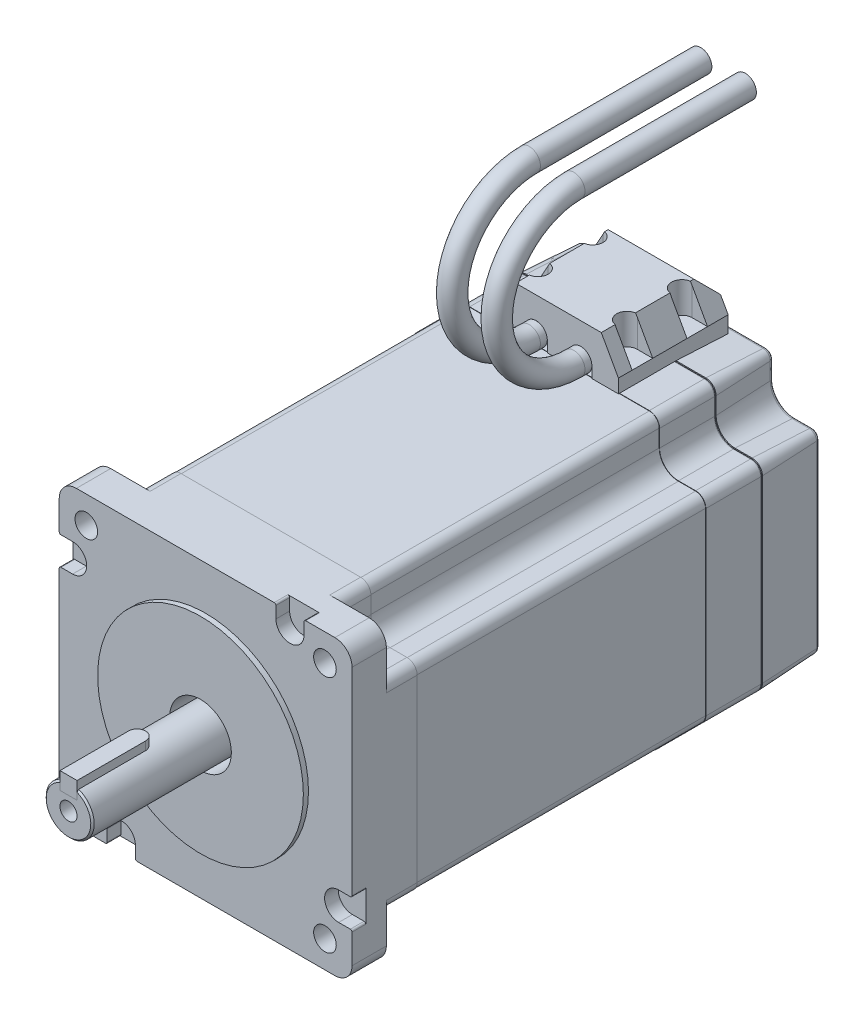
SolidWorks part; units mm, degrees
ref_plane "Front Plane" through (0, 0, 0) normal (0, 0, 1) x (1, 0, 0)
ref_plane "Top Plane" through (0, 0, 0) normal (0, 1, 0) x (1, 0, 0)
ref_plane "Right Plane" through (0, 0, 0) normal (1, 0, 0) x (0, 0, -1)
sketch "Sketch1" plane through (0, 0, 0) normal (0, 0, 1) x (1, 0, 0)
  line L1 (-42.7, -42.7) -> (42.7, -42.7)
  line L2 (-42.7, -42.7) -> (-42.7, 42.7)
  line L3 (-42.7, 42.7) -> (42.7, 42.7)
  line L4 (42.7, -42.7) -> (42.7, 42.7)
  line L5 (-42.7, -42.7) -> (42.7, 42.7) construction
  line L6 (-42.7, 42.7) -> (42.7, -42.7) construction
  point P0 (0, 0)
  dimension "D1" = 85.4
extrude "Boss-Extrude1" add sketch "Sketch1" against normal blind 20.5
sketch "Sketch2" plane through (0, 0, 0) normal (0, 0, 1) x (1, 0, 0)
  circle A0 centre (0, 0) radius 30
  dimension "D1" = 60
extrude "Cut-Extrude1" cut sketch "Sketch2" against normal blind 1.5 flip side to cut
fillet "Fillet1" radius 5 4 edges at (-42.7, -42.7, -11) (42.7, -42.7, -11) (42.7, 42.7, -11) (-42.7, 42.7, -11)
sketch "Sketch3" plane through (0, 0, -1.5) normal (0, 0, 1) x (1, 0, 0)
  line L1 (-34.8, -34.8) -> (34.8, -34.8) construction
  line L2 (-34.8, -34.8) -> (-34.8, 34.8) construction
  line L3 (-34.8, 34.8) -> (34.8, 34.8) construction
  line L4 (34.8, -34.8) -> (34.8, 34.8) construction
  line L5 (-34.8, -34.8) -> (34.8, 34.8) construction
  line L6 (-34.8, 34.8) -> (34.8, -34.8) construction
  circle A0 centre (-34.8, 34.8) radius 3.3
  circle A1 centre (34.8, 34.8) radius 3.3
  circle A2 centre (34.8, -34.8) radius 3.3
  circle A3 centre (-34.8, -34.8) radius 3.3
  circle A4 centre (0, 0) radius 9
  point P0 (0, 0)
  dimension "D1" = 6.6
  dimension "D3" = 18
  dimension "D2" = 69.6
extrude "Cut-Extrude2" cut sketch "Sketch3" against normal through all both and the other way through all
sketch "Sketch4" plane through (0, 0, -1.5) normal (0, 0, 1) x (1, 0, 0)
  line L0 (-58.8, 24.6) -> (-38.8, 24.6) construction
  line L1 (-58.8, 28.7) -> (-38.8, 28.7)
  line L2 (-58.8, 20.5) -> (-38.8, 20.5)
  line L3 (-37.7, 42.7) -> (37.7, 42.7) construction
  line L4 (-42.7, -37.7) -> (-42.7, 37.7) construction
  arc A0 (-58.8, 28.7) -> (-58.8, 20.5) centre (-58.8, 24.6) ccw
  arc A1 (-38.8, 20.5) -> (-38.8, 28.7) centre (-38.8, 24.6) ccw
  point P2 (-48.8, 24.6)
  point P11 (-34.7, 24.6)
  dimension "D1" = 8.2
  dimension "D2" = 20
  dimension "D3" = 14
  dimension "D4" = 8
extrude "Cut-Extrude3" cut sketch "Sketch4" against normal blind 4
fillet "Fillet2" radius 0.5 2 edges at (-42.7, 20.5, -3.5) (-42.7, 28.7, -3.5)
sketch "Sketch5" plane through (0, 0, -20.5) normal (0, 0, -1) x (-1, 0, 0)
  line L0 (-29.2, 42.7) -> (-29.2, 34.7)
  line L1 (-37.7, 42.7) -> (37.7, 42.7) construction
  line L2 (-34.7, 29.2) -> (-42.7, 29.2)
  line L3 (-42.7, -37.7) -> (-42.7, 37.7) construction
  line L4 (-42.7, 29.2) -> (-42.7, 42.7)
  line L5 (-42.7, 42.7) -> (-29.2, 42.7)
  arc A0 (-29.2, 34.7) -> (-34.7, 29.2) centre (-34.7, 34.7) cw
  dimension "D2" = 5.5
  dimension "D1" = 13.5
extrude "Cut-Extrude4" cut sketch "Sketch5" against normal offset from surface (9 mm away) 10
pattern_circular "CirPattern2" count 4 over 360 about axis through (0, 0, 0) along (0, 0, 1) of "Cut-Extrude3", "Fillet2"
pattern_circular "CirPattern7" count 4 over 360 about axis through (0, 0, 0) along (0, 0, 1) of "Cut-Extrude4"
fillet "Fillet3" radius 3 8 edges at (42.7, 29.2, -16) (29.2, 42.7, -16) (-42.7, 29.2, -16) (-29.2, 42.7, -16) (-29.2, -42.7, -16) (-42.7, -29.2, -16) (29.2, -42.7, -16) (42.7, -29.2, -16)
sketch "Sketch6" plane through (0, 0, -20.5) normal (0, 0, -1) x (-1, 0, 0)
  line L24 (42.6, -26.2) -> (42.6, 26.2)
  line L25 (39.7, 29.1) -> (34.7, 29.1)
  line L26 (29.1, 34.7) -> (29.1, 39.7)
  line L27 (26.2, 42.6) -> (-26.2, 42.6)
  line L28 (-29.1, 39.7) -> (-29.1, 34.7)
  line L29 (-34.7, 29.1) -> (-39.7, 29.1)
  line L30 (-42.6, 26.2) -> (-42.6, -26.2)
  line L31 (-39.7, -29.1) -> (-34.7, -29.1)
  line L32 (-29.1, -34.7) -> (-29.1, -39.7)
  line L33 (-26.2, -42.6) -> (26.2, -42.6)
  line L34 (29.1, -39.7) -> (29.1, -34.7)
  line L35 (34.7, -29.1) -> (39.7, -29.1)
  line L36 (42.6, -26.2) -> (42.6, 26.2)
  line L37 (39.7, 29.1) -> (34.7, 29.1)
  line L38 (29.1, 34.7) -> (29.1, 39.7)
  line L39 (26.2, 42.6) -> (-26.2, 42.6)
  line L40 (-29.1, 39.7) -> (-29.1, 34.7)
  line L41 (-34.7, 29.1) -> (-39.7, 29.1)
  line L42 (-42.6, 26.2) -> (-42.6, -26.2)
  line L43 (-39.7, -29.1) -> (-34.7, -29.1)
  line L44 (-29.1, -34.7) -> (-29.1, -39.7)
  line L45 (-26.2, -42.6) -> (26.2, -42.6)
  line L46 (29.1, -39.7) -> (29.1, -34.7)
  line L47 (34.7, -29.1) -> (39.7, -29.1)
  circle A12 centre (0, 0) radius 30
  arc A24 (42.6, 26.2) -> (39.7, 29.1) centre (39.7, 26.2) ccw
  arc A25 (29.1, 34.7) -> (34.7, 29.1) centre (34.7, 34.7) ccw
  arc A26 (29.1, 39.7) -> (26.2, 42.6) centre (26.2, 39.7) ccw
  arc A27 (-26.2, 42.6) -> (-29.1, 39.7) centre (-26.2, 39.7) ccw
  arc A28 (-34.7, 29.1) -> (-29.1, 34.7) centre (-34.7, 34.7) ccw
  arc A29 (-39.7, 29.1) -> (-42.6, 26.2) centre (-39.7, 26.2) ccw
  arc A30 (-42.6, -26.2) -> (-39.7, -29.1) centre (-39.7, -26.2) ccw
  arc A31 (-29.1, -34.7) -> (-34.7, -29.1) centre (-34.7, -34.7) ccw
  arc A32 (-29.1, -39.7) -> (-26.2, -42.6) centre (-26.2, -39.7) ccw
  arc A33 (26.2, -42.6) -> (29.1, -39.7) centre (26.2, -39.7) ccw
  arc A34 (34.7, -29.1) -> (29.1, -34.7) centre (34.7, -34.7) ccw
  arc A35 (39.7, -29.1) -> (42.6, -26.2) centre (39.7, -26.2) ccw
  arc A36 (42.6, 26.2) -> (39.7, 29.1) centre (39.7, 26.2) ccw
  arc A37 (29.1, 34.7) -> (34.7, 29.1) centre (34.7, 34.7) ccw
  arc A38 (29.1, 39.7) -> (26.2, 42.6) centre (26.2, 39.7) ccw
  arc A39 (-26.2, 42.6) -> (-29.1, 39.7) centre (-26.2, 39.7) ccw
  arc A40 (-34.7, 29.1) -> (-29.1, 34.7) centre (-34.7, 34.7) ccw
  arc A41 (-39.7, 29.1) -> (-42.6, 26.2) centre (-39.7, 26.2) ccw
  arc A42 (-42.6, -26.2) -> (-39.7, -29.1) centre (-39.7, -26.2) ccw
  arc A43 (-29.1, -34.7) -> (-34.7, -29.1) centre (-34.7, -34.7) ccw
  arc A44 (-29.1, -39.7) -> (-26.2, -42.6) centre (-26.2, -39.7) ccw
  arc A45 (26.2, -42.6) -> (29.1, -39.7) centre (26.2, -39.7) ccw
  arc A46 (34.7, -29.1) -> (29.1, -34.7) centre (34.7, -34.7) ccw
  arc A47 (39.7, -29.1) -> (42.6, -26.2) centre (39.7, -26.2) ccw
  dimension "D2" = 60
  dimension "D1" = 0.1
extrude "Boss-Extrude2" add sketch "Sketch6" along normal blind 84.2 separate body
sketch "Sketch7" plane through (0, 0, -104.7) normal (0, 0, -1) x (-1, 0, 0)
  line L12 (42.7, -26.2) -> (42.7, 26.2)
  line L13 (39.7, 29.2) -> (34.7, 29.2)
  line L14 (29.2, 34.7) -> (29.2, 39.7)
  line L15 (26.2, 42.7) -> (-26.2, 42.7)
  line L16 (-29.2, 39.7) -> (-29.2, 34.7)
  line L17 (-34.7, 29.2) -> (-39.7, 29.2)
  line L18 (-42.7, 26.2) -> (-42.7, -26.2)
  line L19 (-39.7, -29.2) -> (-34.7, -29.2)
  line L20 (-29.2, -34.7) -> (-29.2, -39.7)
  line L21 (-26.2, -42.7) -> (26.2, -42.7)
  line L22 (29.2, -39.7) -> (29.2, -34.7)
  line L23 (34.7, -29.2) -> (39.7, -29.2)
  line L24 (42.7, -26.2) -> (42.7, 26.2)
  line L25 (39.7, 29.2) -> (34.7, 29.2)
  line L26 (29.2, 34.7) -> (29.2, 39.7)
  line L27 (26.2, 42.7) -> (-26.2, 42.7)
  line L28 (-29.2, 39.7) -> (-29.2, 34.7)
  line L29 (-34.7, 29.2) -> (-39.7, 29.2)
  line L30 (-42.7, 26.2) -> (-42.7, -26.2)
  line L31 (-39.7, -29.2) -> (-34.7, -29.2)
  line L32 (-29.2, -34.7) -> (-29.2, -39.7)
  line L33 (-26.2, -42.7) -> (26.2, -42.7)
  line L34 (29.2, -39.7) -> (29.2, -34.7)
  line L35 (34.7, -29.2) -> (39.7, -29.2)
  arc A12 (42.7, 26.2) -> (39.7, 29.2) centre (39.7, 26.2) ccw
  arc A13 (29.2, 34.7) -> (34.7, 29.2) centre (34.7, 34.7) ccw
  arc A14 (29.2, 39.7) -> (26.2, 42.7) centre (26.2, 39.7) ccw
  arc A15 (-26.2, 42.7) -> (-29.2, 39.7) centre (-26.2, 39.7) ccw
  arc A16 (-34.7, 29.2) -> (-29.2, 34.7) centre (-34.7, 34.7) ccw
  arc A17 (-39.7, 29.2) -> (-42.7, 26.2) centre (-39.7, 26.2) ccw
  arc A18 (-42.7, -26.2) -> (-39.7, -29.2) centre (-39.7, -26.2) ccw
  arc A19 (-29.2, -34.7) -> (-34.7, -29.2) centre (-34.7, -34.7) ccw
  arc A20 (-29.2, -39.7) -> (-26.2, -42.7) centre (-26.2, -39.7) ccw
  arc A21 (26.2, -42.7) -> (29.2, -39.7) centre (26.2, -39.7) ccw
  arc A22 (34.7, -29.2) -> (29.2, -34.7) centre (34.7, -34.7) ccw
  arc A23 (39.7, -29.2) -> (42.7, -26.2) centre (39.7, -26.2) ccw
  arc A24 (42.7, 26.2) -> (39.7, 29.2) centre (39.7, 26.2) ccw
  arc A25 (29.2, 34.7) -> (34.7, 29.2) centre (34.7, 34.7) ccw
  arc A26 (29.2, 39.7) -> (26.2, 42.7) centre (26.2, 39.7) ccw
  arc A27 (-26.2, 42.7) -> (-29.2, 39.7) centre (-26.2, 39.7) ccw
  arc A28 (-34.7, 29.2) -> (-29.2, 34.7) centre (-34.7, 34.7) ccw
  arc A29 (-39.7, 29.2) -> (-42.7, 26.2) centre (-39.7, 26.2) ccw
  arc A30 (-42.7, -26.2) -> (-39.7, -29.2) centre (-39.7, -26.2) ccw
  arc A31 (-29.2, -34.7) -> (-34.7, -29.2) centre (-34.7, -34.7) ccw
  arc A32 (-29.2, -39.7) -> (-26.2, -42.7) centre (-26.2, -39.7) ccw
  arc A33 (26.2, -42.7) -> (29.2, -39.7) centre (26.2, -39.7) ccw
  arc A34 (34.7, -29.2) -> (29.2, -34.7) centre (34.7, -34.7) ccw
  arc A35 (39.7, -29.2) -> (42.7, -26.2) centre (39.7, -26.2) ccw
  dimension "D1" = 0
extrude "Boss-Extrude3" add sketch "Sketch7" along normal blind 16.5 separate body
fillet "Fillet4" radius 0.5 24 edges at (-28.3213, 41.8213, -121.2) (-29.2, 37.2, -121.2) (-30.8109, 30.8109, -121.2) (-37.2, 29.2, -121.2) (-41.8213, 28.3213, -121.2) (-42.7, 0, -121.2) (-41.8213, -28.3213, -121.2) (-37.2, -29.2, -121.2) (-30.8109, -30.8109, -121.2) (-29.2, -37.2, -121.2) (-28.3213, -41.8213, -121.2) (0, -42.7, -121.2) (28.3213, -41.8213, -121.2) (29.2, -37.2, -121.2) (30.8109, -30.8109, -121.2) (37.2, -29.2, -121.2) (41.8213, -28.3213, -121.2) (42.7, 0, -121.2) (41.8213, 28.3213, -121.2) (37.2, 29.2, -121.2) (30.8109, 30.8109, -121.2) (29.2, 37.2, -121.2) (28.3213, 41.8213, -121.2) (0, 42.7, -121.2)
sketch "Sketch8" plane through (0, 0, -121.2) normal (0, 0, -1) x (-1, 0, 0)
  line L12 (42.7, -26.2) -> (42.7, 26.2)
  line L13 (39.7, 29.2) -> (34.7, 29.2)
  line L14 (29.2, 34.7) -> (29.2, 39.7)
  line L15 (26.2, 42.7) -> (-26.2, 42.7)
  line L16 (-29.2, 39.7) -> (-29.2, 34.7)
  line L17 (-34.7, 29.2) -> (-39.7, 29.2)
  line L18 (-42.7, 26.2) -> (-42.7, -26.2)
  line L19 (-39.7, -29.2) -> (-34.7, -29.2)
  line L20 (-29.2, -34.7) -> (-29.2, -39.7)
  line L21 (-26.2, -42.7) -> (26.2, -42.7)
  line L22 (29.2, -39.7) -> (29.2, -34.7)
  line L23 (34.7, -29.2) -> (39.7, -29.2)
  line L24 (42.7, -26.2) -> (42.7, 26.2)
  line L25 (39.7, 29.2) -> (34.7, 29.2)
  line L26 (29.2, 34.7) -> (29.2, 39.7)
  line L27 (26.2, 42.7) -> (-26.2, 42.7)
  line L28 (-29.2, 39.7) -> (-29.2, 34.7)
  line L29 (-34.7, 29.2) -> (-39.7, 29.2)
  line L30 (-42.7, 26.2) -> (-42.7, -26.2)
  line L31 (-39.7, -29.2) -> (-34.7, -29.2)
  line L32 (-29.2, -34.7) -> (-29.2, -39.7)
  line L33 (-26.2, -42.7) -> (26.2, -42.7)
  line L34 (29.2, -39.7) -> (29.2, -34.7)
  line L35 (34.7, -29.2) -> (39.7, -29.2)
  arc A12 (42.7, 26.2) -> (39.7, 29.2) centre (39.7, 26.2) ccw
  arc A13 (29.2, 34.7) -> (34.7, 29.2) centre (34.7, 34.7) ccw
  arc A14 (29.2, 39.7) -> (26.2, 42.7) centre (26.2, 39.7) ccw
  arc A15 (-26.2, 42.7) -> (-29.2, 39.7) centre (-26.2, 39.7) ccw
  arc A16 (-34.7, 29.2) -> (-29.2, 34.7) centre (-34.7, 34.7) ccw
  arc A17 (-39.7, 29.2) -> (-42.7, 26.2) centre (-39.7, 26.2) ccw
  arc A18 (-42.7, -26.2) -> (-39.7, -29.2) centre (-39.7, -26.2) ccw
  arc A19 (-29.2, -34.7) -> (-34.7, -29.2) centre (-34.7, -34.7) ccw
  arc A20 (-29.2, -39.7) -> (-26.2, -42.7) centre (-26.2, -39.7) ccw
  arc A21 (26.2, -42.7) -> (29.2, -39.7) centre (26.2, -39.7) ccw
  arc A22 (34.7, -29.2) -> (29.2, -34.7) centre (34.7, -34.7) ccw
  arc A23 (39.7, -29.2) -> (42.7, -26.2) centre (39.7, -26.2) ccw
  arc A24 (42.7, 26.2) -> (39.7, 29.2) centre (39.7, 26.2) ccw
  arc A25 (29.2, 34.7) -> (34.7, 29.2) centre (34.7, 34.7) ccw
  arc A26 (29.2, 39.7) -> (26.2, 42.7) centre (26.2, 39.7) ccw
  arc A27 (-26.2, 42.7) -> (-29.2, 39.7) centre (-26.2, 39.7) ccw
  arc A28 (-34.7, 29.2) -> (-29.2, 34.7) centre (-34.7, 34.7) ccw
  arc A29 (-39.7, 29.2) -> (-42.7, 26.2) centre (-39.7, 26.2) ccw
  arc A30 (-42.7, -26.2) -> (-39.7, -29.2) centre (-39.7, -26.2) ccw
  arc A31 (-29.2, -34.7) -> (-34.7, -29.2) centre (-34.7, -34.7) ccw
  arc A32 (-29.2, -39.7) -> (-26.2, -42.7) centre (-26.2, -39.7) ccw
  arc A33 (26.2, -42.7) -> (29.2, -39.7) centre (26.2, -39.7) ccw
  arc A34 (34.7, -29.2) -> (29.2, -34.7) centre (34.7, -34.7) ccw
  arc A35 (39.7, -29.2) -> (42.7, -26.2) centre (39.7, -26.2) ccw
  dimension "D1" = 0
extrude "Boss-Extrude4" add sketch "Sketch8" along normal blind 17.6 draft 3 separate body
fillet "Fillet5" radius 1 24 edges at (41.1691, 27.6691, -138.8) (37.2, 28.2776, -138.8) (30.1587, 30.1587, -138.8) (28.2776, 37.2, -138.8) (27.6691, 41.1691, -138.8) (0, 41.7776, -138.8) (-27.6691, 41.1691, -138.8) (-28.2776, 37.2, -138.8) (-30.1587, 30.1587, -138.8) (-37.2, 28.2776, -138.8) (-41.1691, 27.6691, -138.8) (-41.7776, 0, -138.8) (-41.1691, -27.6691, -138.8) (-37.2, -28.2776, -138.8) (-30.1587, -30.1587, -138.8) (-28.2776, -37.2, -138.8) (-27.6691, -41.1691, -138.8) (0, -41.7776, -138.8) (27.6691, -41.1691, -138.8) (28.2776, -37.2, -138.8) (30.1587, -30.1587, -138.8) (37.2, -28.2776, -138.8) (41.1691, -27.6691, -138.8) (41.7776, 0, -138.8)
sketch "Sketch9" plane through (0, 0, 0) normal (0, 1, 0) x (1, 0, 0)
  line L0 (0, 0) -> (0, 138.8) construction
  line L1 (-24, 140) -> (-38, 138.8)
  line L2 (-24, 140) -> (0, 140)
  line L3 (0, 140) -> (0, 138.8)
  line L4 (0, 138.8) -> (-38, 138.8)
  line L5 (-26.2, 138.8) -> (26.2, 138.8) construction
  line L6 (-30, 0) -> (30, 0) construction
  dimension "D1" = 48
  dimension "D2" = 76
  dimension "D3" = 140
revolve "Revolve1" add sketch "Sketch9" angle 360 about L0
shell "Shell1" thickness 2
sketch "Sketch10" plane through (0, 42.7, 0) normal (0, 1, 0) x (1, 0, 0)
  line L0 (0, 0) -> (0, 120.4) construction
  line L1 (-17.5, 104.4) -> (17.5, 104.4)
  line L2 (-17.5, 104.4) -> (-17.5, 136.4)
  line L3 (-17.5, 136.4) -> (17.5, 136.4)
  line L4 (17.5, 104.4) -> (17.5, 136.4)
  line L5 (-17.5, 104.4) -> (17.5, 136.4) construction
  line L6 (-17.5, 136.4) -> (17.5, 104.4) construction
  line L7 (-37.7, 1.5) -> (20, 1.5) construction
  point P0 (0, 120.4)
  dimension "D1" = 35
  dimension "D2" = 32
  dimension "D3" = 102.9
extrude "Boss-Extrude5" add sketch "Sketch10" along normal blind 13 and the other way up to next separate body
chamfer "Chamfer1" distance 5 angle 45 1 edges at (0, 55.7, -136.4)
chamfer "Chamfer2" distance 9 distance2 5 2 edges at (-17.5, 55.7, -117.9) (17.5, 55.7, -117.9)
sketch "Sketch11" plane through (0, 55.7, 0) normal (0, 1, 0) x (1, 0, 0)
  line L0 (-35.0504, 111.4) -> (-13, 111.4) construction
  line L1 (-35.0504, 114.4) -> (-13, 114.4)
  line L2 (-35.0504, 108.4) -> (-13, 108.4)
  line L3 (-35.0504, 127.4) -> (-13, 127.4) construction
  line L4 (-35.0504, 130.4) -> (-13, 130.4)
  line L5 (-35.0504, 124.4) -> (-13, 124.4)
  line L6 (13, 127.4) -> (35.0504, 127.4) construction
  line L8 (13, 130.4) -> (35.0504, 130.4)
  line L9 (13, 124.4) -> (35.0504, 124.4)
  line L10 (35.0504, 111.4) -> (13, 111.4) construction
  line L11 (35.0504, 108.4) -> (13, 108.4)
  line L12 (35.0504, 114.4) -> (13, 114.4)
  line L13 (0, 104.4) -> (0, 73.9799) construction
  line L14 (-12.5, 104.4) -> (12.5, 104.4) construction
  arc A0 (-35.0504, 114.4) -> (-35.0504, 108.4) centre (-35.0504, 111.4) ccw
  arc A1 (-13, 108.4) -> (-13, 114.4) centre (-13, 111.4) ccw
  arc A2 (-35.0504, 130.4) -> (-35.0504, 124.4) centre (-35.0504, 127.4) ccw
  arc A3 (-13, 124.4) -> (-13, 130.4) centre (-13, 127.4) ccw
  arc A4 (13, 130.4) -> (13, 124.4) centre (13, 127.4) ccw
  arc A5 (35.0504, 124.4) -> (35.0504, 130.4) centre (35.0504, 127.4) ccw
  arc A6 (35.0504, 108.4) -> (35.0504, 114.4) centre (35.0504, 111.4) ccw
  arc A7 (13, 114.4) -> (13, 108.4) centre (13, 111.4) ccw
  point P2 (-24.0252, 111.4)
  point P8 (-24.0252, 127.4)
  point P15 (24.0252, 127.4)
  point P24 (24.0252, 111.4)
  dimension "D3" = 26
  dimension "D1" = 6
  dimension "D2" = 22.0504
  dimension "D4" = 16
  dimension "D5" = 4
extrude "Cut-Extrude5" cut sketch "Sketch11" against normal blind 9
shell "Shell2" thickness 1
sketch "Sketch12" plane through (0, 0, -104.4) normal (0, 0, 1) x (1, 0, 0)
  line L0 (-6.5, 39.45) -> (-6.5, 45.95) construction
  line L1 (-17.5, 42.7) -> (17.5, 42.7) construction
  line L2 (-9.75, 39.45) -> (-9.75, 45.95)
  line L3 (-3.25, 39.45) -> (-3.25, 45.95)
  line L4 (6.5, 39.45) -> (6.5, 45.95) construction
  line L5 (-37.7, 42.7) -> (20, 42.7) construction
  line L6 (3.25, 39.45) -> (3.25, 45.95)
  line L7 (9.75, 39.45) -> (9.75, 45.95)
  line L8 (0, 55.7) -> (0, 20.6787) construction
  line L9 (-12.5, 55.7) -> (12.5, 55.7) construction
  arc A0 (-9.75, 39.45) -> (-3.25, 39.45) centre (-6.5, 39.45) ccw
  arc A1 (-3.25, 45.95) -> (-9.75, 45.95) centre (-6.5, 45.95) ccw
  arc A2 (3.25, 39.45) -> (9.75, 39.45) centre (6.5, 39.45) ccw
  arc A3 (9.75, 45.95) -> (3.25, 45.95) centre (6.5, 45.95) ccw
  point P4 (-6.5, 42.7)
  point P10 (6.5, 42.7)
  dimension "D3" = 13
  dimension "D1" = 6.5
  dimension "D2" = 6.5
extrude "Cut-Extrude6" cut sketch "Sketch12" against normal up to next
sketch "Sketch13" plane through (0, 0, 0) normal (0, 0, 1) x (1, 0, 0)
  circle A0 centre (0, 0) radius 7
  dimension "D1" = 14
extrude "Boss-Extrude6" add sketch "Sketch13" along normal blind 38.5 and the other way up to surface separate body
chamfer "Chamfer3" distance 0.5 angle 45 1 edges at (7, 0, 38.5)
hole_wizard "M6 Tapped Hole1" positions "Sketch14" profile "Sketch16" tap size "M6" standard "AS"
sketch "Sketch14" plane through (0, 0, 38.5) normal (0, 0, 1) x (1, 0, 0)
  point P0 (0, 0)
sketch "Sketch16" plane through (0, 0, 38.5) normal (1, 0, 0) x (0, -1, 0)
  line L0 (0, 0) -> (0, 24.5022)
  line L1 (0, 24.5022) -> (2.5, 23)
  line L2 (2.5, 23) -> (2.5, 0)
  line L5 (2.5, 0) -> (0, 0)
  line L10 (0, 24.5022) -> (-2.5, 23) construction
  line L11 (0, -6.35) -> (0, 107.95) construction
  dimension "Tap Drill Dia." = 5
  dimension "Tap Drill Depth" = 23
  dimension "Drill Angle" = 118
ref_plane "Plane1" through (0, 7, 0) normal (0, 1, 0) x (1, 0, 0)
sketch "Sketch17" plane through (0, 7, 0) normal (0, 1, 0) x (1, 0, 0)
  line L0 (0, -38.5) -> (0, -18.5) construction
  line L1 (-6.5, -38.5) -> (6.5, -38.5) construction
  line L2 (-2.5, -38.5) -> (-2.5, -18.5)
  line L3 (2.5, -38.5) -> (2.5, -18.5)
  arc A0 (-2.5, -38.5) -> (2.5, -38.5) centre (0, -38.5) ccw
  arc A1 (2.5, -18.5) -> (-2.5, -18.5) centre (0, -18.5) ccw
  point P5 (0, -28.5)
  dimension "D1" = 5
  dimension "D2" = 20
extrude "Cut-Extrude7" cut sketch "Sketch17" against normal blind 3
sketch "Sketch18" plane through (0, 4, 0) normal (0, 1, 0) x (1, 0, 0)
  line L3 (2.5, -38.5) -> (2.5, -18.5)
  line L4 (-2.5, -18.5) -> (-2.5, -38.5)
  line L5 (-2.5, -38.5) -> (2.5, -38.5)
  line L6 (2.5, -38.5) -> (2.5, -18.5)
  line L7 (-2.5, -18.5) -> (-2.5, -38.5)
  line L8 (-2.5, -38.5) -> (2.5, -38.5)
  arc A1 (2.5, -18.5) -> (-2.5, -18.5) centre (0, -18.5) ccw
  arc A2 (2.5, -18.5) -> (-2.5, -18.5) centre (0, -18.5) ccw
  dimension "D1" = 0
extrude "Boss-Extrude7" add sketch "Sketch18" along normal blind 5 separate body
ref_plane "Plane2" through (-6.5, 0, 0) normal (1, 0, 0) x (0, 0, -1)
sketch "Sketch20" plane through (-6.5, 0, 0) normal (1, 0, 0) x (0, 0, -1)
  line L0 (104.4, 45.95) -> (102.4, 45.95)
  line L1 (102.4, 90.95) -> (152.4, 90.95)
  line L2 (104.4, 49.2) -> (104.4, 45.95) construction
  line L3 (104.4, 49.2) -> (104.4, 45.95) construction
  arc A0 (102.4, 45.95) -> (102.4, 90.95) centre (102.4, 68.45) cw
  dimension "D2" = 22.5
  dimension "D1" = 2
  dimension "D3" = 50
sketch "Sketch21" plane through (0, 0, -104.4) normal (0, 0, 1) x (1, 0, 0)
  arc A0 (9.75, 45.95) -> (3.25, 45.95) centre (6.5, 45.95) ccw construction
  arc A1 (-3.25, 45.95) -> (-9.75, 45.95) centre (-6.5, 45.95) ccw construction
  circle A2 centre (6.5, 45.95) radius 3.25
  circle A3 centre (-6.5, 45.95) radius 3.25
sweep "Sweep1" add profiles "Sketch21" path "Sketch20"
